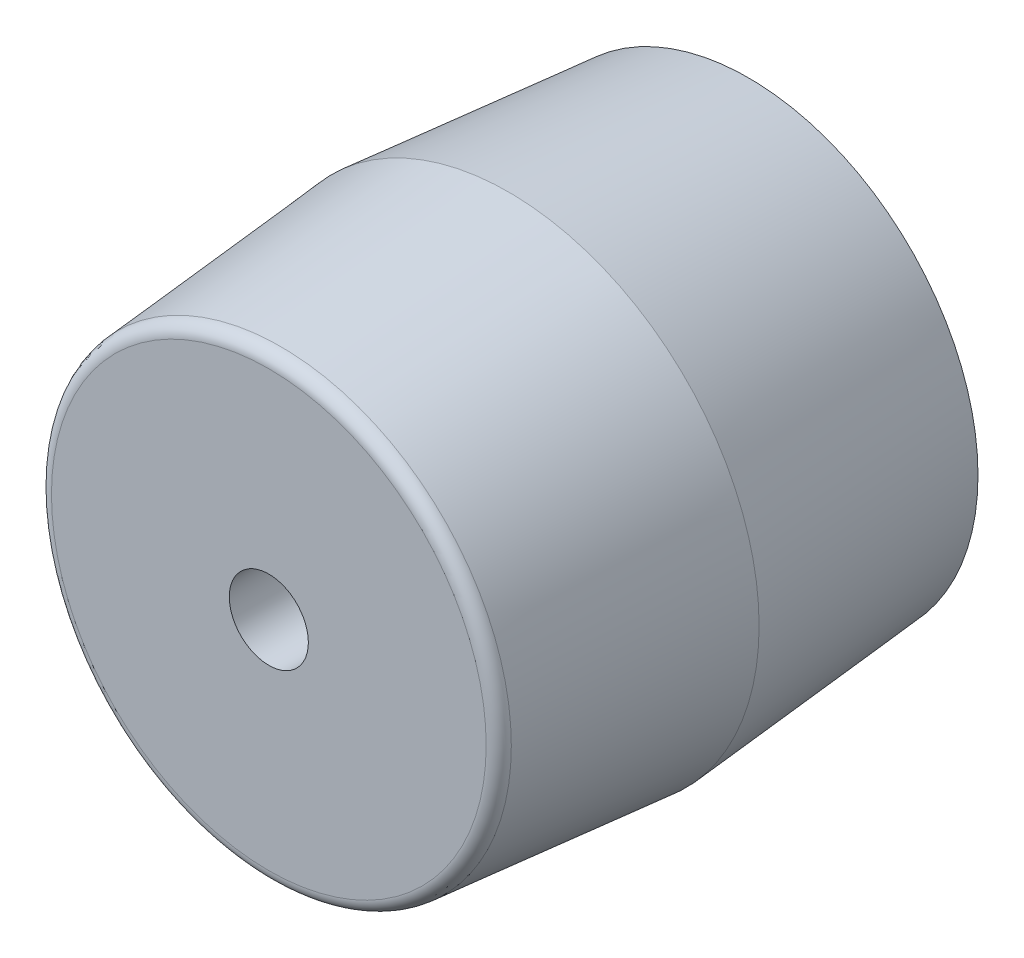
SolidWorks part; units mm, degrees
ref_plane "Front Plane" through (0, 0, 0) normal (0, 0, 1) x (1, 0, 0)
ref_plane "Top Plane" through (0, 0, 0) normal (0, 1, 0) x (1, 0, 0)
ref_plane "Right Plane" through (0, 0, 0) normal (1, 0, 0) x (0, 0, -1)
sketch "Sketch1" plane through (0, 0, 0) normal (0, 0, 1) x (1, 0, 0)
  circle A0 centre (0, 0) radius 9.5
  dimension "D1" = 19
extrude "Boss-Extrude1" add sketch "Sketch1" along normal mid plane 18.2 draft 5
fillet "Fillet1" radius 0.5 1 edges at (8.7039, 0, 9.1)
sketch "Sketch2" plane through (0, 0, 9.1) normal (0, 0, 1) x (1, 0, 0)
  circle A0 centre (0, 0) radius 1.5
extrude "Cut-Extrude1" cut sketch "Sketch2" against normal blind 18.5
